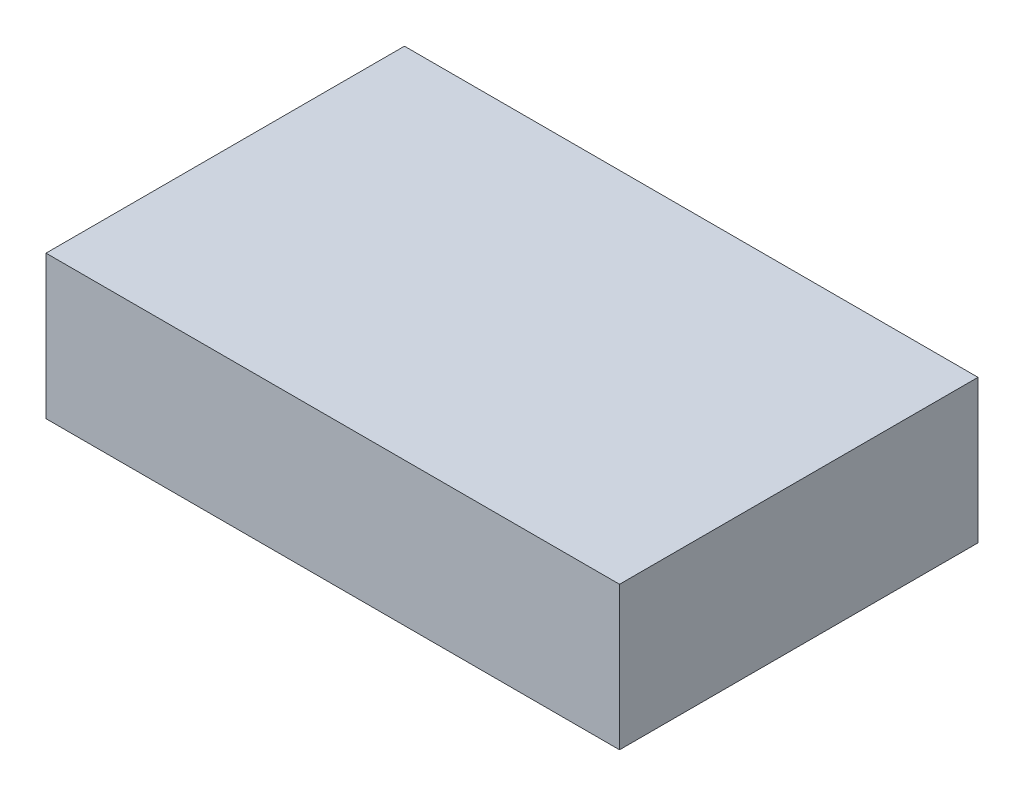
SolidWorks part; units mm, degrees
ref_plane "Front Plane" through (0, 0, 0) normal (0, 0, 1) x (1, 0, 0)
ref_plane "Top Plane" through (0, 0, 0) normal (0, 1, 0) x (1, 0, 0)
ref_plane "Right Plane" through (0, 0, 0) normal (1, 0, 0) x (0, 0, -1)
sketch "Sketch2" plane through (0, 0, 0) normal (0, 1, 0) x (1, 0, 0)
  line L1 (0, 0) -> (25.4, 0)
  line L2 (0, 0) -> (0, 15.875)
  line L3 (0, 15.875) -> (25.4, 15.875)
  line L4 (25.4, 0) -> (25.4, 15.875)
extrude "Boss-Extrude1" add sketch "Sketch2" along normal blind 6.35
